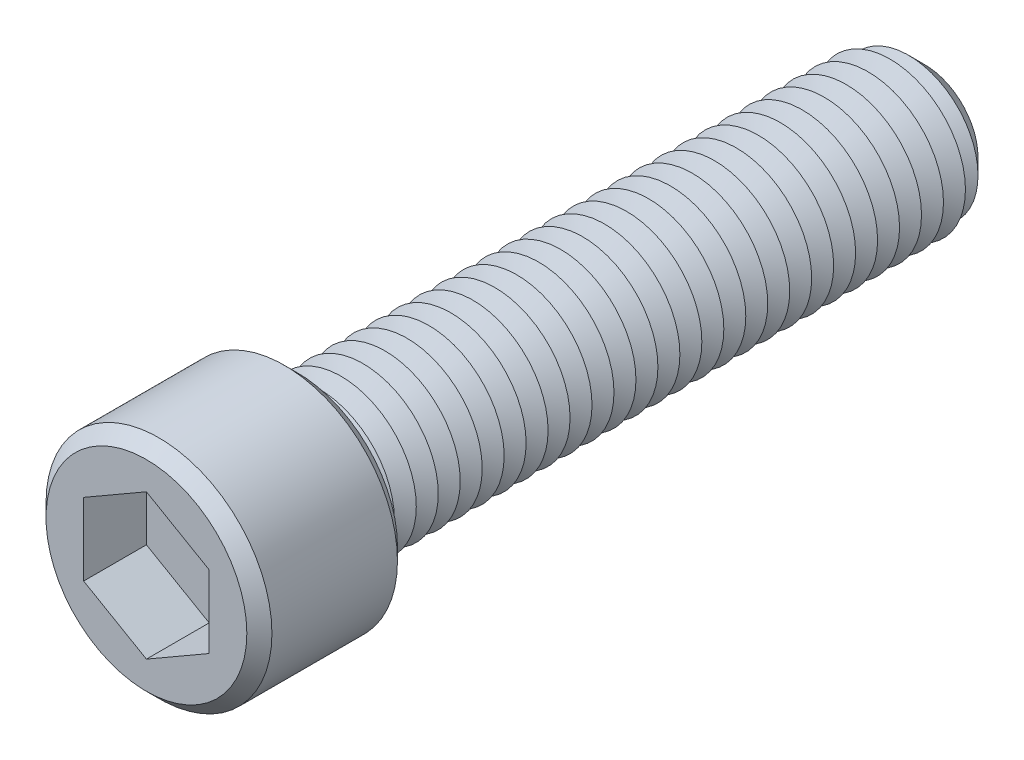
SolidWorks part; units mm, degrees
ref_plane "Front Plane" through (0, 0, 0) normal (0, 0, 1) x (1, 0, 0)
ref_plane "Top Plane" through (0, 0, 0) normal (0, 1, 0) x (1, 0, 0)
ref_plane "Right Plane" through (0, 0, 0) normal (1, 0, 0) x (0, 0, -1)
sketch "Sketch1" plane through (0, 0, 0) normal (0, 0, 1) x (1, 0, 0)
  circle A0 centre (0, 0) radius 9
  dimension "D1" = 18
extrude "Boss-Extrude1" add sketch "Sketch1" along normal blind 12
sketch "Sketch2" plane through (0, 0, 0) normal (0, 0, -1) x (-1, 0, 0)
  circle A0 centre (0, 0) radius 6
  dimension "D1" = 12
extrude "Boss-Extrude2" add sketch "Sketch2" along normal blind 50
chamfer "Chamfer1" distance 1.75 angle 45 1 edges at (-6, 0, -50)
sketch "Sketch3" plane through (0, 0, 0) normal (1, 0, 0) x (0, 0, -1)
  line L0 (-2.5121, 0) -> (4.5776, 0) construction
sketch "Sketch4" plane through (0, 0, 0) normal (1, 0, 0) x (0, 0, -1)
  line L0 (0, 6) -> (0.875, 4.4845)
  line L1 (0.875, 4.4845) -> (1.75, 6)
  line L2 (48.25, 6) -> (0, 6) construction
  line L3 (1.75, 6) -> (0, 6)
  dimension "D1" = 1.75
revolve "Cut-Revolve1" cut sketch "Sketch4" angle 360 about L0
pattern_linear "LPattern1" count 28 spacing 1.75 along (0, 0, -1) of "Cut-Revolve1"
sketch "Sketch5" plane through (0, 0, 12) normal (0, 0, 1) x (1, 0, 0)
  line L1 (0, 5.7735) -> (-5, 2.8868)
  line L2 (-5, 2.8868) -> (-5, -2.8868)
  line L3 (-5, -2.8868) -> (0, -5.7735)
  line L4 (0, -5.7735) -> (5, -2.8868)
  line L5 (5, -2.8868) -> (5, 2.8868)
  line L6 (5, 2.8868) -> (0, 5.7735)
  circle A0 centre (0, 0) radius 5 construction
  dimension "D1" = 10
extrude "Cut-Extrude1" cut sketch "Sketch5" against normal blind 5
sketch "Sketch6" plane through (0, 0, 7) normal (0, 0, 1) x (1, 0, 0)
  circle A0 centre (0, 0) radius 0.9
  dimension "D1" = 1.8
extrude "Cut-Extrude2" cut sketch "Sketch6" against normal up to surface (57 mm away)
chamfer "Chamfer2" distance 1 angle 45 2 edges at (9, 0, 0) (9, 0, 12)
